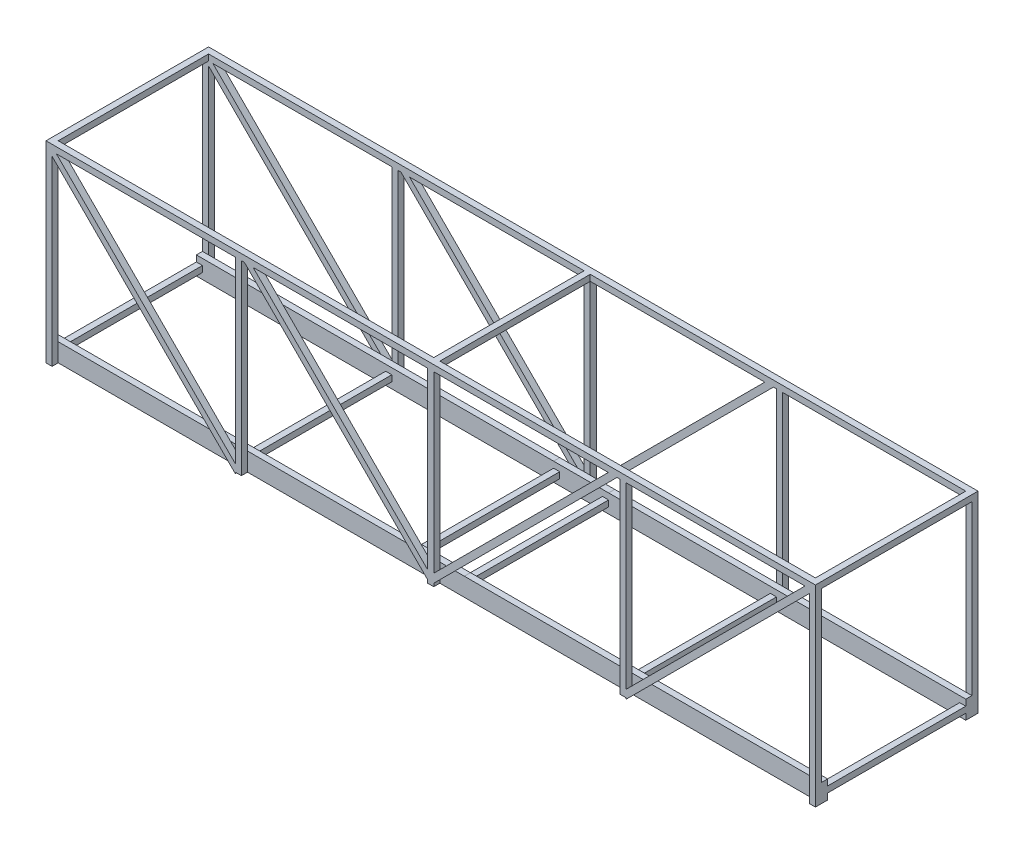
SolidWorks part; units mm, degrees
ref_plane "Front Plane" through (0, 0, 0) normal (0, 0, 1) x (1, 0, 0)
ref_plane "Top Plane" through (0, 0, 0) normal (0, 1, 0) x (1, 0, 0)
ref_plane "Right Plane" through (0, 0, 0) normal (1, 0, 0) x (0, 0, -1)
sketch "Sketch1" plane through (0, 0, 0) normal (0, 1, 0) x (1, 0, 0)
  line L0 (0, 37.5) -> (0, -37.5) construction
  line L1 (-200, -37.5) -> (200, -37.5)
  line L2 (-200, -37.5) -> (-200, 37.5)
  line L3 (-200, 37.5) -> (200, 37.5)
  line L4 (200, -37.5) -> (200, 37.5)
  line L5 (-200, -37.5) -> (200, 37.5) construction
  line L6 (-200, 37.5) -> (200, -37.5) construction
  line L7 (-100, 37.5) -> (-100, -37.5)
  line L8 (-12.7, -37.5) -> (-12.7, 37.5)
  line L9 (12.7, 37.5) -> (12.7, -37.5)
  line L10 (100, 37.5) -> (100, -37.5)
  point P0 (0, 0)
  dimension "D1" = 400
  dimension "D2" = 75
  dimension "D3" = 25.4
  dimension "D4" = 100
  dimension "D5" = 100
other "Structural Member1"
ref_plane "Plane1" through (-200, 0, 37.5) normal (1, 0, 0) x (0, 0, -1)
sketch "Sketch12" plane through (-200, 0, 37.5) normal (1, 0, 0) x (0, 0, -1)
  line L1 (-1.5875, -4.7625) -> (1.5875, -4.7625)
  line L2 (-1.5875, -4.7625) -> (-1.5875, 4.7625)
  line L3 (-1.5875, 4.7625) -> (1.5875, 4.7625)
  line L4 (1.5875, -4.7625) -> (1.5875, 4.7625)
  line L5 (-1.5875, -4.7625) -> (1.5875, 4.7625) construction
  line L6 (-1.5875, 4.7625) -> (1.5875, -4.7625) construction
  point P0 (0, 0)
  point P5 (0, 4.7625)
  point P6 (1.5875, 0)
  point P7 (0, -4.7625)
  point P8 (-1.5875, 0)
  point P9 (0, 0)
  dimension "D1" = 3.175
  dimension "D2" = 9.525
other "Structural Member2"
ref_plane "Plane2" through (200, 0, 37.5) normal (0, 0, -1) x (-1, 0, 0)
sketch "Sketch14" plane through (198.4125, 0, 37.5) normal (0, 0, -1) x (-1, 0, 0)
  line L1 (-1.5875, -1.5875) -> (1.5875, -1.5875)
  line L2 (-1.5875, -1.5875) -> (-1.5875, 1.5875)
  line L3 (-1.5875, 1.5875) -> (1.5875, 1.5875)
  line L4 (1.5875, -1.5875) -> (1.5875, 1.5875)
  line L5 (-1.5875, -1.5875) -> (1.5875, 1.5875) construction
  line L6 (-1.5875, 1.5875) -> (1.5875, -1.5875) construction
  point P0 (0, 0)
  point P5 (-1.5875, 0)
  point P6 (0, 1.5875)
  point P7 (1.5875, 0)
  point P8 (0, -1.5875)
  point P9 (0, 0)
  dimension "D1" = 3.175
other "Structural Member3"
ref_plane "Plane3" through (-200, 0, 37.5) normal (0, 0, -1) x (-1, 0, 0)
sketch "Sketch15" plane through (-198.4125, 0, 37.5) normal (0, 0, -1) x (-1, 0, 0)
  line L1 (-1.5875, -1.5875) -> (1.5875, -1.5875)
  line L2 (-1.5875, -1.5875) -> (-1.5875, 1.5875)
  line L3 (-1.5875, 1.5875) -> (1.5875, 1.5875)
  line L4 (1.5875, -1.5875) -> (1.5875, 1.5875)
  line L5 (-1.5875, -1.5875) -> (1.5875, 1.5875) construction
  line L6 (-1.5875, 1.5875) -> (1.5875, -1.5875) construction
  point P0 (0, 0)
  point P5 (-1.5875, 0)
  point P6 (0, 1.5875)
  point P7 (1.5875, 0)
  point P8 (0, -1.5875)
  point P9 (0, 0)
  dimension "D1" = 3.175
other "Structural Member4"
ref_plane "Plane4" through (-100, 0, -37.5) normal (0, 0, 1) x (1, 0, 0)
sketch "Sketch16" plane through (-100, 0, -37.5) normal (0, 0, 1) x (1, 0, 0)
  line L1 (-1.5875, -1.5875) -> (1.5875, -1.5875)
  line L2 (-1.5875, -1.5875) -> (-1.5875, 1.5875)
  line L3 (-1.5875, 1.5875) -> (1.5875, 1.5875)
  line L4 (1.5875, -1.5875) -> (1.5875, 1.5875)
  line L5 (-1.5875, -1.5875) -> (1.5875, 1.5875) construction
  line L6 (-1.5875, 1.5875) -> (1.5875, -1.5875) construction
  point P0 (0, 0)
  point P5 (-1.5875, 0)
  point P6 (0, 1.5875)
  point P7 (1.5875, 0)
  point P8 (0, -1.5875)
  point P9 (0, 0)
  dimension "D1" = 3.175
other "Trim/Extend1"
sketch "Sketch18" plane through (0, 0, 39.0875) normal (0, 0, 1) x (1, 0, 0)
  line L0 (-200, -4.7625) -> (-200, 95.2375)
  line L1 (-200, 95.2375) -> (200, 95.2375)
  line L2 (200, -4.7625) -> (200, 95.2375)
  line L3 (0, -4.7625) -> (0, 95.2375)
  line L4 (200, -4.7625) -> (-200, -4.7625) construction
  line L5 (-100, 95.2375) -> (-100, -4.7625)
  line L6 (100, 95.2375) -> (100, -4.7625)
  dimension "D1" = 100
  dimension "D2" = 100
  dimension "D3" = 100
other "Structural Member5"
ref_plane "Plane5" through (-200, -4.7625, 39.0875) normal (0, 1, 0) x (-1, 0, 0)
sketch "Sketch17" plane through (-198.4125, -4.7625, 40.675) normal (0, 1, 0) x (-1, 0, 0)
  line L1 (-1.5875, -1.5875) -> (1.5875, -1.5875)
  line L2 (-1.5875, -1.5875) -> (-1.5875, 1.5875)
  line L3 (-1.5875, 1.5875) -> (1.5875, 1.5875)
  line L4 (1.5875, -1.5875) -> (1.5875, 1.5875)
  line L5 (-1.5875, -1.5875) -> (1.5875, 1.5875) construction
  line L6 (-1.5875, 1.5875) -> (1.5875, -1.5875) construction
  point P0 (0, 0)
  point P5 (-1.5875, 0)
  point P6 (0, 1.5875)
  point P7 (1.5875, 0)
  point P8 (0, -1.5875)
  point P9 (0, 0)
  dimension "D1" = 3.175
other "Structural Member6"
ref_plane "Plane6" through (200, -4.7625, 39.0875) normal (0, 1, 0) x (-1, 0, 0)
sketch "Sketch19" plane through (198.4125, -4.7625, 40.675) normal (0, 1, 0) x (-1, 0, 0)
  line L1 (-1.5875, -1.5875) -> (1.5875, -1.5875)
  line L2 (-1.5875, -1.5875) -> (-1.5875, 1.5875)
  line L3 (-1.5875, 1.5875) -> (1.5875, 1.5875)
  line L4 (1.5875, -1.5875) -> (1.5875, 1.5875)
  line L5 (-1.5875, -1.5875) -> (1.5875, 1.5875) construction
  line L6 (-1.5875, 1.5875) -> (1.5875, -1.5875) construction
  point P0 (0, 0)
  point P5 (-1.5875, 0)
  point P6 (0, 1.5875)
  point P7 (1.5875, 0)
  point P8 (0, -1.5875)
  point P9 (0, 0)
  dimension "D1" = 3.175
other "Structural Member7"
ref_plane "Plane7" through (100, 95.2375, 39.0875) normal (0, -1, 0) x (1, 0, 0)
sketch "Sketch110" plane through (100, 95.2375, 40.675) normal (0, -1, 0) x (1, 0, 0)
  line L1 (-1.5875, -1.5875) -> (1.5875, -1.5875)
  line L2 (-1.5875, -1.5875) -> (-1.5875, 1.5875)
  line L3 (-1.5875, 1.5875) -> (1.5875, 1.5875)
  line L4 (1.5875, -1.5875) -> (1.5875, 1.5875)
  line L5 (-1.5875, -1.5875) -> (1.5875, 1.5875) construction
  line L6 (-1.5875, 1.5875) -> (1.5875, -1.5875) construction
  point P0 (0, 0)
  point P5 (-1.5875, 0)
  point P6 (0, 1.5875)
  point P7 (1.5875, 0)
  point P8 (0, -1.5875)
  point P9 (0, 0)
  dimension "D1" = 3.175
other "Structural Member8"
ref_plane "Plane8" through (-200, 95.2375, 39.0875) normal (1, 0, 0) x (0, 1, 0)
sketch "Sketch111" plane through (-200, 93.65, 40.675) normal (1, 0, 0) x (0, 1, 0)
  line L1 (-1.5875, -1.5875) -> (1.5875, -1.5875)
  line L2 (-1.5875, -1.5875) -> (-1.5875, 1.5875)
  line L3 (-1.5875, 1.5875) -> (1.5875, 1.5875)
  line L4 (1.5875, -1.5875) -> (1.5875, 1.5875)
  line L5 (-1.5875, -1.5875) -> (1.5875, 1.5875) construction
  line L6 (-1.5875, 1.5875) -> (1.5875, -1.5875) construction
  point P0 (0, 0)
  point P5 (-1.5875, 0)
  point P6 (0, 1.5875)
  point P7 (1.5875, 0)
  point P8 (0, -1.5875)
  point P9 (0, 0)
  dimension "D1" = 3.175
other "Trim/Extend2"
sketch "Sketch124" plane through (0, 0, -39.0875) normal (0, 0, -1) x (-1, 0, 0)
  line L0 (-200, -4.7625) -> (-200, 95.2375)
  line L1 (200, -4.7625) -> (200, 95.2375)
  line L2 (0, -4.7625) -> (0, 95.2375)
  line L3 (-200, -4.7625) -> (200, -4.7625) construction
  line L4 (-100, -4.7625) -> (-100, 95.2375)
  line L5 (100, -4.7625) -> (100, 95.2375)
  line L6 (200, 95.2375) -> (-200, 95.2375)
  line L7 (200, 95.2375) -> (-200, 95.2375) construction
  line L8 (-100, 95.2375) -> (-100, -4.7625) construction
  line L9 (100, 95.2375) -> (100, -4.7625) construction
other "Structural Member15"
ref_plane "Plane16" through (200, -4.7625, -39.0875) normal (0, 1, 0) x (1, 0, 0)
sketch "Sketch125" plane through (198.4125, -4.7625, -40.675) normal (0, 1, 0) x (1, 0, 0)
  line L1 (-1.5875, -1.5875) -> (1.5875, -1.5875)
  line L2 (-1.5875, -1.5875) -> (-1.5875, 1.5875)
  line L3 (-1.5875, 1.5875) -> (1.5875, 1.5875)
  line L4 (1.5875, -1.5875) -> (1.5875, 1.5875)
  line L5 (-1.5875, -1.5875) -> (1.5875, 1.5875) construction
  line L6 (-1.5875, 1.5875) -> (1.5875, -1.5875) construction
  point P0 (0, 0)
  point P5 (-1.5875, 0)
  point P6 (0, 1.5875)
  point P7 (1.5875, 0)
  point P8 (0, -1.5875)
  point P9 (0, 0)
  dimension "D1" = 3.175
other "Structural Member16"
ref_plane "Plane17" through (-200, -4.7625, -39.0875) normal (0, 1, 0) x (1, 0, 0)
sketch "Sketch126" plane through (-198.4125, -4.7625, -40.675) normal (0, 1, 0) x (1, 0, 0)
  line L1 (-1.5875, -1.5875) -> (1.5875, -1.5875)
  line L2 (-1.5875, -1.5875) -> (-1.5875, 1.5875)
  line L3 (-1.5875, 1.5875) -> (1.5875, 1.5875)
  line L4 (1.5875, -1.5875) -> (1.5875, 1.5875)
  line L5 (-1.5875, -1.5875) -> (1.5875, 1.5875) construction
  line L6 (-1.5875, 1.5875) -> (1.5875, -1.5875) construction
  point P0 (0, 0)
  point P5 (-1.5875, 0)
  point P6 (0, 1.5875)
  point P7 (1.5875, 0)
  point P8 (0, -1.5875)
  point P9 (0, 0)
  dimension "D1" = 3.175
other "Structural Member17"
ref_plane "Plane18" through (100, -4.7625, -39.0875) normal (0, 1, 0) x (1, 0, 0)
sketch "Sketch127" plane through (100, -4.7625, -40.675) normal (0, 1, 0) x (1, 0, 0)
  line L1 (-1.5875, -1.5875) -> (1.5875, -1.5875)
  line L2 (-1.5875, -1.5875) -> (-1.5875, 1.5875)
  line L3 (-1.5875, 1.5875) -> (1.5875, 1.5875)
  line L4 (1.5875, -1.5875) -> (1.5875, 1.5875)
  line L5 (-1.5875, -1.5875) -> (1.5875, 1.5875) construction
  line L6 (-1.5875, 1.5875) -> (1.5875, -1.5875) construction
  point P0 (0, 0)
  point P5 (-1.5875, 0)
  point P6 (0, 1.5875)
  point P7 (1.5875, 0)
  point P8 (0, -1.5875)
  point P9 (0, 0)
  dimension "D1" = 3.175
other "Structural Member18"
ref_plane "Plane19" through (-200, 95.2375, -39.0875) normal (1, 0, 0) x (0, -1, 0)
sketch "Sketch128" plane through (-200, 93.65, -40.675) normal (1, 0, 0) x (0, -1, 0)
  line L1 (-1.5875, -1.5875) -> (1.5875, -1.5875)
  line L2 (-1.5875, -1.5875) -> (-1.5875, 1.5875)
  line L3 (-1.5875, 1.5875) -> (1.5875, 1.5875)
  line L4 (1.5875, -1.5875) -> (1.5875, 1.5875)
  line L5 (-1.5875, -1.5875) -> (1.5875, 1.5875) construction
  line L6 (-1.5875, 1.5875) -> (1.5875, -1.5875) construction
  point P0 (0, 0)
  point P5 (-1.5875, 0)
  point P6 (0, 1.5875)
  point P7 (1.5875, 0)
  point P8 (0, -1.5875)
  point P9 (0, 0)
  dimension "D1" = 3.175
other "Trim/Extend3"
sketch "Sketch112" plane through (0, 0, 39.0875) normal (0, 0, 1) x (1, 0, 0)
  line L0 (0, -4.7625) -> (100, 95.2375)
  line L1 (200, -4.7625) -> (-200, -4.7625) construction
  line L3 (-100, 95.2375) -> (0, -4.7625)
other "Structural Member9"
ref_plane "Plane9" through (0, -4.7625, 39.0875) normal (0.7071, 0.7071, 0) x (-0.7071, 0.7071, 0)
sketch "Sketch113" plane through (-1.1225, -3.64, 40.675) normal (0.7071, 0.7071, 0) x (-0.7071, 0.7071, 0)
  line L1 (-1.5875, -1.5875) -> (1.5875, -1.5875)
  line L2 (-1.5875, -1.5875) -> (-1.5875, 1.5875)
  line L3 (-1.5875, 1.5875) -> (1.5875, 1.5875)
  line L4 (1.5875, -1.5875) -> (1.5875, 1.5875)
  line L5 (-1.5875, -1.5875) -> (1.5875, 1.5875) construction
  line L6 (-1.5875, 1.5875) -> (1.5875, -1.5875) construction
  point P0 (0, 0)
  point P5 (-1.5875, 0)
  point P6 (0, 1.5875)
  point P7 (1.5875, 0)
  point P8 (0, -1.5875)
  point P9 (0, 0)
  dimension "D1" = 3.175
other "Trim/Extend6"
sketch "Sketch129" plane through (0, 0, -39.0875) normal (0, 0, -1) x (-1, 0, 0)
  line L0 (0, -4.7625) -> (100, 95.2375)
  line L1 (0, -4.7625) -> (-100, 95.2375)
other "Structural Member19"
ref_plane "Plane20" through (0, -4.7625, -39.0875) normal (0.7071, 0.7071, 0) x (0.7071, -0.7071, 0)
sketch "Sketch130" plane through (-1.1225, -3.64, -40.675) normal (0.7071, 0.7071, 0) x (0.7071, -0.7071, 0)
  line L1 (-1.5875, -1.5875) -> (1.5875, -1.5875)
  line L2 (-1.5875, -1.5875) -> (-1.5875, 1.5875)
  line L3 (-1.5875, 1.5875) -> (1.5875, 1.5875)
  line L4 (1.5875, -1.5875) -> (1.5875, 1.5875)
  line L5 (-1.5875, -1.5875) -> (1.5875, 1.5875) construction
  line L6 (-1.5875, 1.5875) -> (1.5875, -1.5875) construction
  point P0 (0, 0)
  point P5 (-1.5875, 0)
  point P6 (0, 1.5875)
  point P7 (1.5875, 0)
  point P8 (0, -1.5875)
  point P9 (0, 0)
  dimension "D1" = 3.175
other "Trim/Extend17"
sketch "Sketch115" plane through (0, 0, 39.0875) normal (0, 0, 1) x (1, 0, 0)
  line L0 (100, -4.7625) -> (200, 95.2375)
  line L1 (-200, 95.2375) -> (-100, -4.7625)
other "Structural Member10"
ref_plane "Plane11" through (100, -4.7625, 39.0875) normal (0.7071, 0.7071, 0) x (-0.7071, 0.7071, 0)
sketch "Sketch116" plane through (100, -4.7625, 40.675) normal (0.7071, 0.7071, 0) x (-0.7071, 0.7071, 0)
  line L1 (-1.5875, -1.5875) -> (1.5875, -1.5875)
  line L2 (-1.5875, -1.5875) -> (-1.5875, 1.5875)
  line L3 (-1.5875, 1.5875) -> (1.5875, 1.5875)
  line L4 (1.5875, -1.5875) -> (1.5875, 1.5875)
  line L5 (-1.5875, -1.5875) -> (1.5875, 1.5875) construction
  line L6 (-1.5875, 1.5875) -> (1.5875, -1.5875) construction
  point P0 (0, 0)
  point P5 (-1.5875, 0)
  point P6 (0, 1.5875)
  point P7 (1.5875, 0)
  point P8 (0, -1.5875)
  point P9 (0, 0)
  dimension "D1" = 3.175
other "Trim/Extend8"
other "Structural Member11"
ref_plane "Plane12" through (-200, 95.2375, 39.0875) normal (0.7071, -0.7071, 0) x (0.7071, 0.7071, 0)
sketch "Sketch117" plane through (-200, 95.2375, 40.675) normal (0.7071, -0.7071, 0) x (0.7071, 0.7071, 0)
  line L1 (-1.5875, -1.5875) -> (1.5875, -1.5875)
  line L2 (-1.5875, -1.5875) -> (-1.5875, 1.5875)
  line L3 (-1.5875, 1.5875) -> (1.5875, 1.5875)
  line L4 (1.5875, -1.5875) -> (1.5875, 1.5875)
  line L5 (-1.5875, -1.5875) -> (1.5875, 1.5875) construction
  line L6 (-1.5875, 1.5875) -> (1.5875, -1.5875) construction
  point P0 (0, 0)
  point P5 (-1.5875, 0)
  point P6 (0, 1.5875)
  point P7 (1.5875, 0)
  point P8 (0, -1.5875)
  point P9 (0, 0)
  dimension "D1" = 3.175
other "Trim/Extend16"
other "Trim/Extend15"
sketch "Sketch132" plane through (0, 0, -39.0875) normal (0, 0, -1) x (-1, 0, 0)
  line L0 (-100, -4.7625) -> (-200, 95.2375)
  line L1 (100, -4.7625) -> (200, 95.2375)
other "Structural Member21"
ref_plane "Plane22" through (-100, -4.7625, -39.0875) normal (-0.7071, 0.7071, 0) x (0.7071, 0.7071, 0)
sketch "Sketch133" plane through (-100, -4.7625, -40.675) normal (-0.7071, 0.7071, 0) x (0.7071, 0.7071, 0)
  line L1 (-1.5875, -1.5875) -> (1.5875, -1.5875)
  line L2 (-1.5875, -1.5875) -> (-1.5875, 1.5875)
  line L3 (-1.5875, 1.5875) -> (1.5875, 1.5875)
  line L4 (1.5875, -1.5875) -> (1.5875, 1.5875)
  line L5 (-1.5875, -1.5875) -> (1.5875, 1.5875) construction
  line L6 (-1.5875, 1.5875) -> (1.5875, -1.5875) construction
  point P0 (0, 0)
  point P5 (-1.5875, 0)
  point P6 (0, 1.5875)
  point P7 (1.5875, 0)
  point P8 (0, -1.5875)
  point P9 (0, 0)
  dimension "D1" = 3.175
other "Trim/Extend13"
other "Structural Member22"
ref_plane "Plane23" through (100, -4.7625, -39.0875) normal (0.7071, 0.7071, 0) x (0.7071, -0.7071, 0)
sketch "Sketch134" plane through (100, -4.7625, -40.675) normal (0.7071, 0.7071, 0) x (0.7071, -0.7071, 0)
  line L1 (-1.5875, -1.5875) -> (1.5875, -1.5875)
  line L2 (-1.5875, -1.5875) -> (-1.5875, 1.5875)
  line L3 (-1.5875, 1.5875) -> (1.5875, 1.5875)
  line L4 (1.5875, -1.5875) -> (1.5875, 1.5875)
  line L5 (-1.5875, -1.5875) -> (1.5875, 1.5875) construction
  line L6 (-1.5875, 1.5875) -> (1.5875, -1.5875) construction
  point P0 (0, 0)
  point P5 (-1.5875, 0)
  point P6 (0, 1.5875)
  point P7 (1.5875, 0)
  point P8 (0, -1.5875)
  point P9 (0, 0)
  dimension "D1" = 3.175
other "Trim/Extend14"
sketch "Sketch118" plane through (0, 95.2375, 0) normal (0, 1, 0) x (1, 0, 0)
  line L0 (200, -39.0875) -> (200, 39.0875)
  line L1 (-200, -39.0875) -> (-200, 39.0875)
  line L2 (200, 39.0875) -> (-200, 39.0875) construction
other "Structural Member12"
ref_plane "Plane13" through (200, 95.2375, 39.0875) normal (0, 0, -1) x (-1, 0, 0)
sketch "Sketch119" plane through (198.4125, 93.65, 39.0875) normal (0, 0, -1) x (-1, 0, 0)
  line L1 (-1.5875, -1.5875) -> (1.5875, -1.5875)
  line L2 (-1.5875, -1.5875) -> (-1.5875, 1.5875)
  line L3 (-1.5875, 1.5875) -> (1.5875, 1.5875)
  line L4 (1.5875, -1.5875) -> (1.5875, 1.5875)
  line L5 (-1.5875, -1.5875) -> (1.5875, 1.5875) construction
  line L6 (-1.5875, 1.5875) -> (1.5875, -1.5875) construction
  point P0 (0, 0)
  point P5 (-1.5875, 0)
  point P6 (0, 1.5875)
  point P7 (1.5875, 0)
  point P8 (0, -1.5875)
  point P9 (0, 0)
  dimension "D1" = 3.175
other "Structural Member13"
ref_plane "Plane14" through (-200, 95.2375, 39.0875) normal (0, 0, -1) x (-1, 0, 0)
sketch "Sketch120" plane through (-198.4125, 93.65, 39.0875) normal (0, 0, -1) x (-1, 0, 0)
  line L1 (-1.5875, -1.5875) -> (1.5875, -1.5875)
  line L2 (-1.5875, -1.5875) -> (-1.5875, 1.5875)
  line L3 (-1.5875, 1.5875) -> (1.5875, 1.5875)
  line L4 (1.5875, -1.5875) -> (1.5875, 1.5875)
  line L5 (-1.5875, -1.5875) -> (1.5875, 1.5875) construction
  line L6 (-1.5875, 1.5875) -> (1.5875, -1.5875) construction
  point P0 (0, 0)
  point P5 (-1.5875, 0)
  point P6 (0, 1.5875)
  point P7 (1.5875, 0)
  point P8 (0, -1.5875)
  point P9 (0, 0)
  dimension "D1" = 3.175
sketch "Sketch121" plane through (0, 95.2375, 0) normal (0, 1, 0) x (1, 0, 0)
  line L0 (0, -39.0875) -> (0, 39.0875)
  line L1 (200, -39.0875) -> (-200, -39.0875) construction
  line L3 (-200, 39.0875) -> (200, 39.0875) construction
other "Structural Member14"
ref_plane "Plane15" through (0, 95.2375, 39.0875) normal (0, 0, -1) x (-1, 0, 0)
sketch "Sketch123" plane through (0, 93.65, 39.0875) normal (0, 0, -1) x (-1, 0, 0)
  line L1 (-1.5875, -1.5875) -> (1.5875, -1.5875)
  line L2 (-1.5875, -1.5875) -> (-1.5875, 1.5875)
  line L3 (-1.5875, 1.5875) -> (1.5875, 1.5875)
  line L4 (1.5875, -1.5875) -> (1.5875, 1.5875)
  line L5 (-1.5875, -1.5875) -> (1.5875, 1.5875) construction
  line L6 (-1.5875, 1.5875) -> (1.5875, -1.5875) construction
  point P0 (0, 0)
  point P5 (-1.5875, 0)
  point P6 (0, 1.5875)
  point P7 (1.5875, 0)
  point P8 (0, -1.5875)
  point P9 (0, 0)
  dimension "D1" = 3.175
combine bodies "Combine1" operation type add bodies to combine 154 112 125 173 104 130 146 115 157 128 196 147 155 113 197 206 126 174 153 111 116 158 103 129 145 156 114 127 181 195 205
sketch "Sketch135" plane through (0, -4.7625, 0) normal (0, -1, 0) x (1, 0, 0)
  line L0 (200, 35.9125) -> (-200, 35.9125) construction
  line L1 (-200, 42.2625) -> (-196.825, 42.2625)
  line L2 (-200, 42.2625) -> (-200, 35.9125)
  line L3 (-200, 35.9125) -> (-196.825, 35.9125)
  line L4 (-196.825, 42.2625) -> (-196.825, 35.9125)
  line L5 (200, -35.9125) -> (-200, -35.9125) construction
  line L6 (-200, -42.2625) -> (-196.825, -42.2625)
  line L7 (-200, -42.2625) -> (-200, -35.9125)
  line L8 (-200, -35.9125) -> (-196.825, -35.9125)
  line L9 (-196.825, -42.2625) -> (-196.825, -35.9125)
  line L11 (200, -42.2625) -> (196.825, -42.2625)
  line L12 (200, -42.2625) -> (200, -35.9125)
  line L13 (200, -35.9125) -> (196.825, -35.9125)
  line L14 (196.825, -42.2625) -> (196.825, -35.9125)
  line L15 (200, 42.2625) -> (196.825, 42.2625)
  line L16 (200, 42.2625) -> (200, 35.9125)
  line L17 (200, 35.9125) -> (196.825, 35.9125)
  line L18 (196.825, 42.2625) -> (196.825, 35.9125)
sketch "Sketch136" plane through (0, 4.7625, 0) normal (0, 1, 0) x (1, 0, 0)
  line L0 (-9.525, 39.0875) -> (-98.4125, 39.0875) construction
  line L1 (-14.2875, 39.0875) -> (14.2875, 39.0875)
  line L2 (-14.2875, 39.0875) -> (-14.2875, 35.9125)
  line L3 (-14.2875, 35.9125) -> (14.2875, 35.9125)
  line L4 (14.2875, 39.0875) -> (14.2875, 35.9125)
  line L5 (200, 35.9125) -> (-200, 35.9125) construction
  line L6 (-9.525, -39.0875) -> (-98.4125, -39.0875) construction
  line L7 (-14.2875, -39.0875) -> (14.2875, -39.0875)
  line L8 (-14.2875, -39.0875) -> (-14.2875, -35.9125)
  line L9 (-14.2875, -35.9125) -> (14.2875, -35.9125)
  line L10 (14.2875, -39.0875) -> (14.2875, -35.9125)
  line L11 (200, -35.9125) -> (-200, -35.9125) construction
  line L12 (-14.2875, -35.9125) -> (-14.2875, 35.9125) construction
  line L13 (14.2875, -35.9125) -> (14.2875, 35.9125) construction
equation "\"D2@Sketch12\" = \"D1@Sketch12\" * 3"
